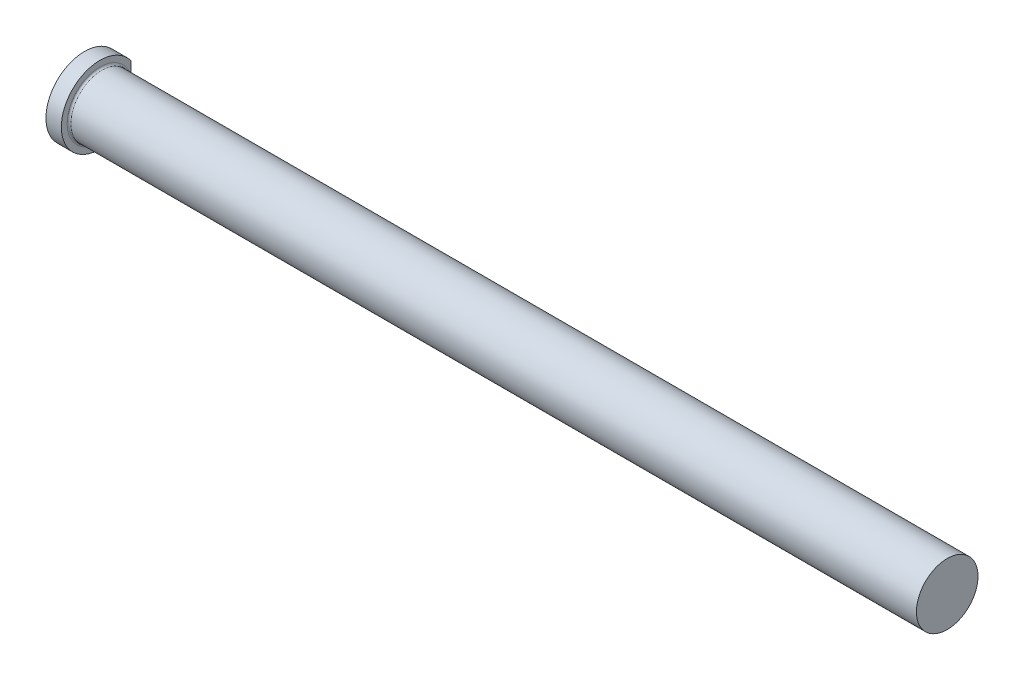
SolidWorks part; units mm, degrees
ref_plane "Front Plane" through (0, 0, 0) normal (0, 0, 1) x (1, 0, 0)
ref_plane "Top Plane" through (0, 0, 0) normal (0, 1, 0) x (1, 0, 0)
ref_plane "Right Plane" through (0, 0, 0) normal (1, 0, 0) x (0, 0, -1)
sketch "Sketch1" plane through (0, 0, 0) normal (0, 0, 1) x (1, 0, 0)
  line L0 (0, 0) -> (0, 15.875)
  line L1 (0, 15.875) -> (6.35, 15.875)
  line L2 (6.35, 15.875) -> (6.35, 13.4811)
  line L3 (7.1374, 12.6937) -> (355.6, 12.6937)
  line L4 (355.6, 12.6937) -> (355.6, 0)
  line L5 (355.6, 0) -> (0, 0)
  line L6 (355.6, 0) -> (0, 0) construction
  line L7 (0, 0) -> (-10.4771, 0) construction
  line L8 (355.6, 0) -> (1002.3976, 0) construction
  line L9 (7.1374, 12.6937) -> (-7.9138, 12.6936) construction
  arc A0 (7.1374, 12.6937) -> (6.35, 13.4811) centre (7.1374, 13.4811) cw
  dimension "D1" = 0.7874
  dimension "HeadDia" = 31.75
  dimension "HeadThickness" = 6.35
  dimension "PinDia" = 25.3873
  dimension "overall" = 355.6
revolve "PIN" add sketch "Sketch1" angle 360 about L6
ref_plane "Plane1" through (181.3687, 0, -12.6936) normal (0, 0, -1) x (0, -1, 0)
ref_plane "CutPlane" through (0, 0, -12.8714) normal (0, 0, -1) x (-1, 0, 0)
other "SurfaceCut1"
